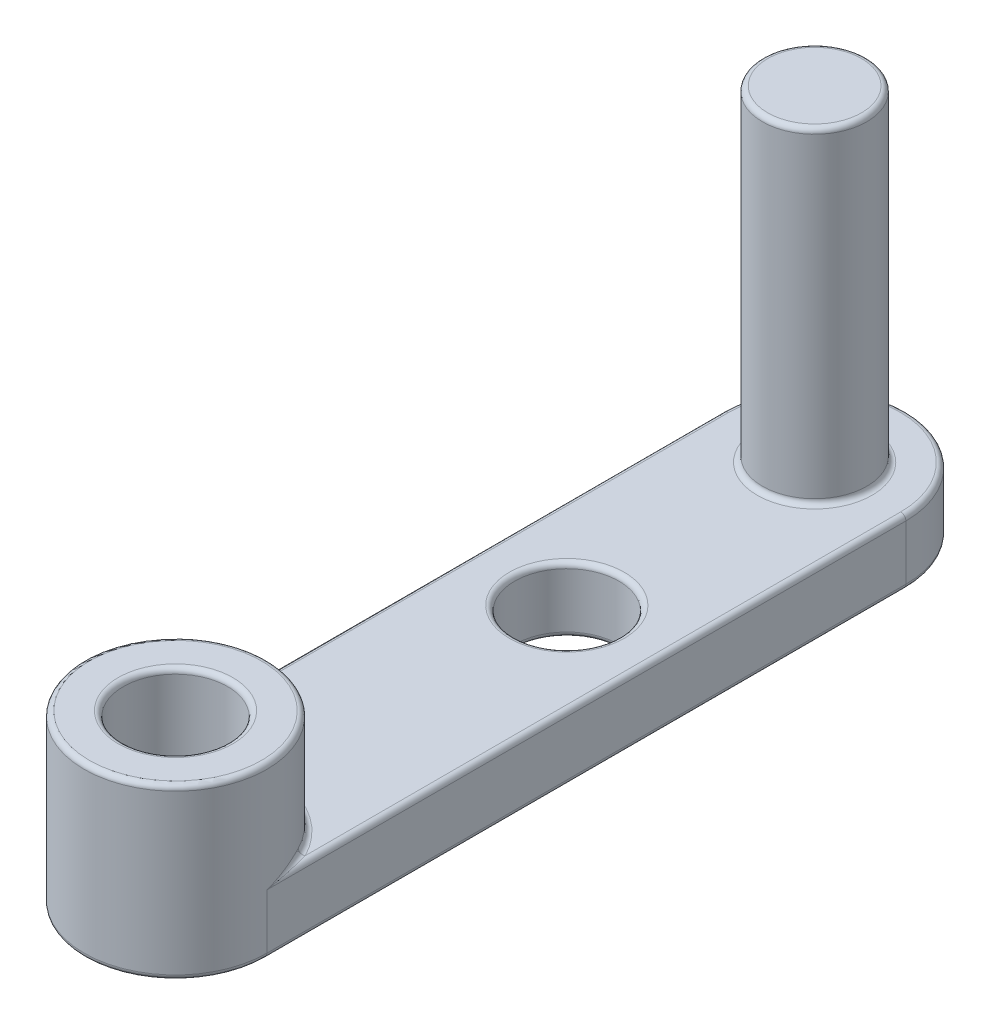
SolidWorks part; units mm, degrees
ref_plane "前视基准面" through (0, 0, 0) normal (0, 0, 1) x (1, 0, 0)
ref_plane "上视基准面" through (0, 0, 0) normal (0, 1, 0) x (1, 0, 0)
ref_plane "右视基准面" through (0, 0, 0) normal (1, 0, 0) x (0, 0, -1)
sketch "草图1" plane through (0, 0, 0) normal (0, 1, 0) x (1, 0, 0)
  line L0 (0, 0) -> (0, 24.5) construction
  line L1 (3.5, 0) -> (3.5, 24.5)
  line L2 (-3.5, 0) -> (-3.5, 24.5)
  arc A0 (-3.5, 0) -> (3.5, 0) centre (0, 0) ccw
  arc A1 (3.5, 24.5) -> (-3.5, 24.5) centre (0, 24.5) ccw
  dimension "D1" = 7
  dimension "D2" = 24.5
extrude "凸台-拉伸1" add sketch "草图1" along normal blind 2.5
sketch "草图2" plane through (0, 2.5, 0) normal (0, 1, 0) x (1, 0, 0)
  circle A0 centre (0, 0) radius 3.5
  circle A1 centre (0, 0) radius 2
  dimension "D1" = 7
  dimension "D2" = 4
extrude "凸台-拉伸2" add sketch "草图2" along normal blind 4
sketch "草图3" plane through (0, 2.5, 0) normal (0, 1, 0) x (1, 0, 0)
  circle A0 centre (0, 24.5) radius 2
  dimension "D1" = 4
extrude "凸台-拉伸3" add sketch "草图3" along normal blind 12.5
sketch "草图4" plane through (0, 2.5, 0) normal (0, 1, 0) x (1, 0, 0)
  line L0 (0, 0) -> (0, 15) construction
  circle A0 centre (0, 15) radius 2
  dimension "D2" = 4
  dimension "D1" = 15
extrude "切除-拉伸1" cut sketch "草图4" against normal through all
fillet "圆角1" radius 0.2 14 edges at (0, 15, -22.5) (3.5, 0, -12.25) (0, 0, -28) (-3.5, 0, -12.25) (0, 0, 3.5) (0, 0, -13) (0, 2.5, -22.5) (0, 2.5, -28) (0, 2.5, -13) (0, 6.5, 2) (0, 6.5, 3.5)
